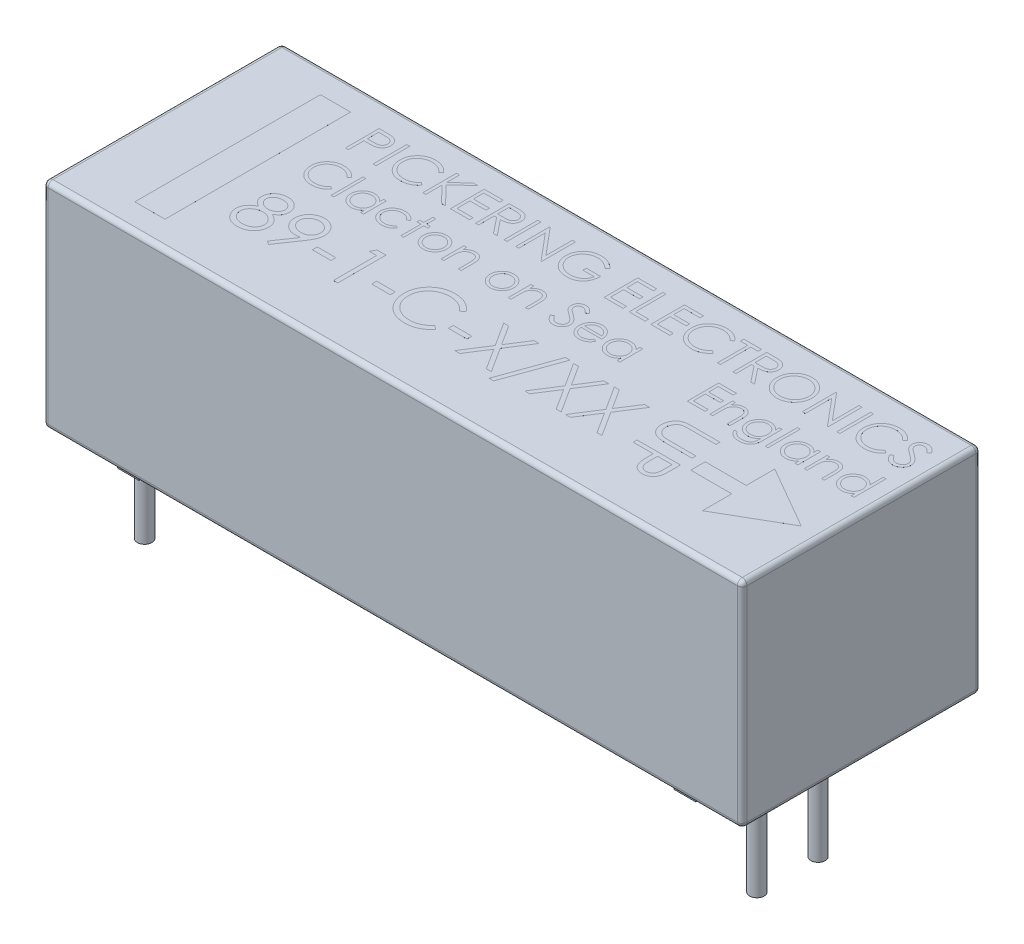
SolidWorks part; units mm, degrees
ref_plane "Front Plane" through (0, 0, 0) normal (0, 0, 1) x (1, 0, 0)
ref_plane "Top Plane" through (0, 0, 0) normal (0, 1, 0) x (1, 0, 0)
ref_plane "Right Plane" through (0, 0, 0) normal (1, 0, 0) x (0, 0, -1)
sketch "Sketch2" plane through (0, 0, 0) normal (0, 1, 0) x (1, 0, 0)
  line L1 (14.5, -4.95) -> (-14.5, -4.95)
  line L2 (14.5, -4.95) -> (14.5, 4.95)
  line L3 (14.5, 4.95) -> (-14.5, 4.95)
  line L4 (-14.5, -4.95) -> (-14.5, 4.95)
  line L5 (14.5, -4.95) -> (-14.5, 4.95) construction
  line L6 (14.5, 4.95) -> (-14.5, -4.95) construction
  point P0 (0, 0)
  dimension "D1" = 9.9
  dimension "D2" = 29
extrude "Main Body" add sketch "Sketch2" along normal blind 8.89 draft 0.023
sketch "Sketch3"
  dimension "D1" = 1.25
  dimension "D2" = 7.7
  dimension "D3" = 1.0965
  dimension "D4" = 2.7
  dimension "D5" = 1.4
  dimension "D6" = 2
extrude "Lettering" add sketch "Sketch3" along normal blind 0.0001
sketch "Sketch4" plane through (0, 0, 0) normal (0, -1, 0) x (1, 0, 0)
  line L0 (-14.5, -4.95) -> (-14.5, 4.95) construction
  line L1 (-12, 4.375) -> (-11.1, 4.375)
  line L2 (-12, 4.375) -> (-12, -4.375)
  line L3 (-12, -4.375) -> (-11.1, -4.375)
  line L4 (-11.1, 4.375) -> (-11.1, -4.375)
  line L5 (-14.5, 4.95) -> (14.5, 4.95) construction
  dimension "D1" = 8.75
  dimension "D2" = 0.9
  dimension "D3" = 2.5
  dimension "D4" = 0.575
extrude "Bobbin feet" add sketch "Sketch4" along normal blind 0.51
sketch "Sketch5" plane through (0, -0.51, 0) normal (0, -1, 0) x (1, 0, 0)
  line L0 (-11.1, -4.375) -> (-11.1, 4.375) construction
  line L1 (-11.1, -2.9375) -> (-12, -2.9375)
  line L2 (-11.1, -2.9375) -> (-11.1, -1.9375)
  line L3 (-11.1, -1.9375) -> (-12, -1.9375)
  line L4 (-12, -2.9375) -> (-12, -1.9375)
  line L5 (-12, 4.375) -> (-12, -4.375) construction
  line L6 (-12, 4.375) -> (-12, -4.375) construction
  line L7 (-12, -0.5) -> (-11.1, -0.5)
  line L8 (-12, -0.5) -> (-12, 0.5)
  line L9 (-12, 0.5) -> (-11.1, 0.5)
  line L10 (-11.1, -0.5) -> (-11.1, 0.5)
  line L11 (-11.1, 1.9375) -> (-12, 1.9375)
  line L12 (-11.1, 1.9375) -> (-11.1, 2.9375)
  line L13 (-11.1, 2.9375) -> (-12, 2.9375)
  line L14 (-12, 1.9375) -> (-12, 2.9375)
  line L15 (-12, -4.375) -> (-11.1, -4.375) construction
  dimension "D1" = 1.4375
  dimension "D2" = 1
  dimension "D3" = 1.4375
  dimension "D4" = 1
  dimension "D5" = 1
  dimension "D6" = 1.4375
extrude "Bobbin feet cut" cut sketch "Sketch5" against normal up to surface (0.51 mm away)
sketch "Sketch8" plane through (0, 0, 0) normal (0, -1, 0) x (1, 0, 0)
  line L0 (-14.5, -4.95) -> (-14.5, 4.95) construction
  line L1 (-12, -4.375) -> (-13.925, -4.375)
  line L2 (-12, -4.375) -> (-12, -2.9375)
  line L3 (-12, -2.9375) -> (-13.925, -2.9375)
  line L4 (-13.925, -4.375) -> (-13.925, -2.9375)
  line L5 (-12, -2.9375) -> (-11.1, -2.9375) construction
  dimension "D1" = 0.575
extrude "Extrude5" add sketch "Sketch8" along normal blind 0.1
pattern_linear "LPattern1" count 4 spacing 2.4385 along (0, 0, 1) of "Extrude5"
mirror "Mirror1" about plane through (0, 0, 0) normal (1, 0, 0) of "Extrude5", "Bobbin feet cut", "Bobbin feet", "LPattern1"
sketch "Sketch9" plane through (0, 0, 0) normal (0, -1, 0) x (1, 0, 0)
  line L1 (14.5, 4.95) -> (14.5, -4.95) construction
  circle A0 centre (12.7, 2.54) radius 0.3
  circle A1 centre (12.7, 0) radius 0.2963
  dimension "D1" = 0.6
  dimension "D2" = 2.54
  dimension "D4" = 1.8
extrude "Pins" add sketch "Sketch9" along normal blind 4.31
sketch "Sketch10" plane through (0, 0, 0) normal (0, -1, 0) x (1, 0, 0)
  line L0 (14.5, -4.95) -> (-14.5, -4.95) construction
  line L1 (-14.5, -4.95) -> (-14.5, 4.95) construction
  circle A0 centre (-12.7, -2.54) radius 0.3
  circle A1 centre (-12.7, 0) radius 0.3
  circle A2 centre (-12.7, 2.54) radius 0.3
  dimension "D1" = 0.6
  dimension "D2" = 0.6
  dimension "D3" = 0.6
  dimension "D4" = 2.41
  dimension "D5" = 2.54
  dimension "D6" = 2.54
  dimension "D7" = 1.8
extrude "Extrude7" add sketch "Sketch10" along normal blind 4.31
fillet "Fillet1" radius 0.2 12 edges at (0, 8.89, -4.9465) (0, 0, -4.95) (-14.4983, 4.445, -4.9483) (-14.4965, 8.89, 0) (-14.5, 0, 0) (-14.4983, 4.445, 4.9483) (0, 8.89, 4.9465) (0, 0, 4.95) (14.4983, 4.445, 4.9483) (14.4965, 8.89, 0) (14.4983, 4.445, -4.9483) (14.5, 0, 0)
sketch "Sketch11"
sketch_block_instance "UP-1"
sketch_block "UP"
sketch_block_instance "Block1-1"
sketch_block "Block1" parameters "D1"=1.7, "D2"=2.2, "D3"=2.6, "D4"=1.24
extrude "Extrude8" add sketch "Sketch11" along normal blind 0.0001
